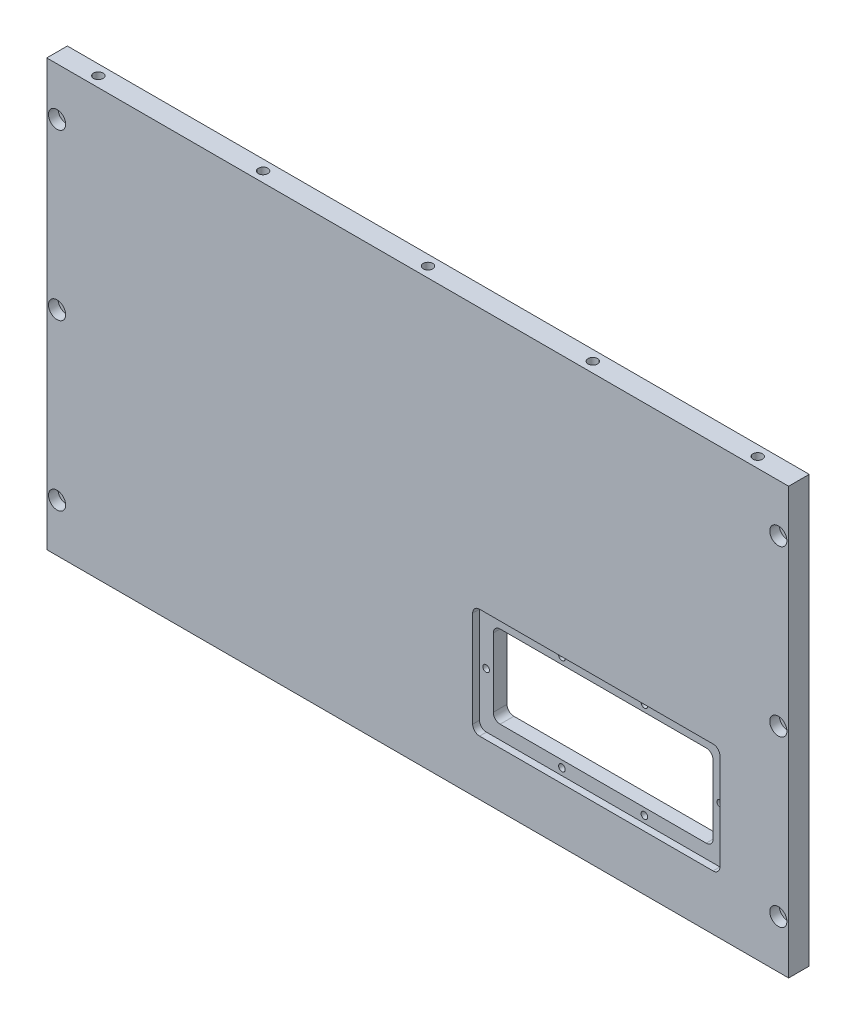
SolidWorks part; units mm, degrees
ref_plane "Front Plane" through (0, 0, 0) normal (0, 0, 1) x (1, 0, 0)
ref_plane "Top Plane" through (0, 0, 0) normal (0, 1, 0) x (1, 0, 0)
ref_plane "Right Plane" through (0, 0, 0) normal (1, 0, 0) x (0, 0, -1)
sketch "Sketch1" plane through (0, 0, 0) normal (0, 0, 1) x (1, 0, 0)
  line L1 (-171.45, 98.425) -> (171.45, 98.425)
  line L2 (-171.45, 98.425) -> (-171.45, -98.425)
  line L3 (-171.45, -98.425) -> (171.45, -98.425)
  line L4 (171.45, 98.425) -> (171.45, -98.425)
  line L5 (-171.45, 98.425) -> (171.45, -98.425) construction
  line L6 (-171.45, -98.425) -> (171.45, 98.425) construction
  point P0 (0, 0)
  dimension "D1" = 196.85
  dimension "D2" = 342.9
extrude "Boss-Extrude1" add sketch "Sketch1" along normal blind 9.525
sketch "Sketch2" plane through (0, 0, 9.525) normal (0, 0, 1) x (1, 0, 0)
  line L1 (34.925, -28.575) -> (130.175, -28.575)
  line L2 (31.75, -31.75) -> (31.75, -63.5)
  line L3 (34.925, -66.675) -> (130.175, -66.675)
  line L4 (133.35, -31.75) -> (133.35, -63.5)
  line L5 (31.75, -28.575) -> (133.35, -66.675) construction
  line L6 (31.75, -66.675) -> (133.35, -28.575) construction
  line L7 (-171.45, -98.425) -> (171.45, -98.425) construction
  line L8 (171.45, -98.425) -> (171.45, 98.425) construction
  arc A0 (133.35, -31.75) -> (130.175, -28.575) centre (130.175, -31.75) ccw
  arc A1 (133.35, -63.5) -> (130.175, -66.675) centre (130.175, -63.5) cw
  arc A2 (31.75, -63.5) -> (34.925, -66.675) centre (34.925, -63.5) ccw
  arc A3 (34.925, -28.575) -> (31.75, -31.75) centre (34.925, -31.75) ccw
  point P0 (82.55, -47.625)
  dimension "D4" = 3.175
  dimension "D1" = 50.8
  dimension "D2" = 38.1
  dimension "D3" = 101.6
  dimension "D5" = 88.9
extrude "Cut-Extrude1" cut sketch "Sketch2" against normal through all
sketch "Sketch3" plane through (0, 0, 9.525) normal (0, 0, 1) x (1, 0, 0)
  line L0 (31.75, -47.625) -> (133.35, -47.625) construction
  line L1 (31.75, -31.75) -> (31.75, -63.5) construction
  line L2 (133.35, -63.5) -> (133.35, -31.75) construction
  line L3 (82.55, -28.575) -> (82.55, -66.675) construction
  line L4 (130.175, -28.575) -> (34.925, -28.575) construction
  line L5 (34.925, -66.675) -> (130.175, -66.675) construction
  line L7 (28.575, -22.225) -> (136.525, -22.225)
  line L8 (25.4, -25.4) -> (25.4, -69.85)
  line L9 (28.575, -73.025) -> (136.525, -73.025)
  line L10 (139.7, -25.4) -> (139.7, -69.85)
  line L11 (25.4, -22.225) -> (139.7, -73.025) construction
  line L12 (25.4, -73.025) -> (139.7, -22.225) construction
  arc A0 (139.7, -69.85) -> (136.525, -73.025) centre (136.525, -69.85) cw
  arc A1 (136.525, -22.225) -> (139.7, -25.4) centre (136.525, -25.4) cw
  arc A2 (28.575, -22.225) -> (25.4, -25.4) centre (28.575, -25.4) ccw
  arc A3 (28.575, -73.025) -> (25.4, -69.85) centre (28.575, -69.85) cw
  point P12 (82.55, -47.625)
  dimension "D3" = 3.175
  dimension "D1" = 6.35
  dimension "D2" = 6.35
extrude "Cut-Extrude2" cut sketch "Sketch3" against normal blind 3.175
sketch "Sketch4" plane through (0, 0, 6.35) normal (0, 0, 1) x (1, 0, 0)
  line L0 (133.35, -63.5) -> (133.35, -31.75) construction
  line L1 (25.4, -47.625) -> (139.7, -47.625) construction
  line L2 (25.4, -25.4) -> (25.4, -69.85) construction
  line L3 (139.7, -69.85) -> (139.7, -25.4) construction
  line L4 (130.175, -28.575) -> (34.925, -28.575) construction
  line L5 (82.55, -28.575) -> (82.55, -66.675) construction
  line L6 (34.925, -66.675) -> (130.175, -66.675) construction
  circle A1 centre (63.5, -25.4) radius 1.524
  circle A2 centre (63.5, -69.85) radius 1.524
  circle A6 centre (101.6, -69.85) radius 1.524
  circle A7 centre (101.6, -25.4) radius 1.524
  circle A8 centre (136.652, -47.625) radius 1.524
  circle A9 centre (28.448, -47.625) radius 1.524
  dimension "D1" = 19.05
  dimension "D2" = 3.048
  dimension "D3" = 3.175
  dimension "D4" = 3.048
  dimension "D5" = 3.302
extrude "Cut-Extrude3" cut sketch "Sketch4" against normal through all
sketch "Sketch6" plane through (0, -98.425, 0) normal (0, -1, 0) x (-1, 0, 0)
  line L0 (171.45, -4.7625) -> (-171.45, -4.7625) construction
  line L1 (171.45, -9.525) -> (171.45, 0) construction
  line L2 (-171.45, -9.525) -> (-171.45, 0) construction
  line L3 (0, -9.525) -> (0, 0) construction
  line L4 (171.45, -9.525) -> (-171.45, -9.525) construction
  circle A0 centre (0, -4.7625) radius 2.1971
  circle A1 centre (76.2, -4.7625) radius 2.1971
  circle A2 centre (152.4, -4.7625) radius 2.1971
  circle A4 centre (-76.2, -4.7625) radius 2.1971
  circle A5 centre (-152.4, -4.7625) radius 2.1971
  dimension "D1" = 4.3942
  dimension "D2" = 3
  dimension "D3" = 3
extrude "Cut-Extrude4" cut sketch "Sketch6" against normal blind 15.24
sketch "Sketch7" plane through (0, 98.425, 0) normal (0, 1, 0) x (1, 0, 0)
  line L0 (-171.45, -4.7625) -> (171.45, -4.7625) construction
  line L1 (-171.45, -9.525) -> (-171.45, 0) construction
  line L2 (171.45, -9.525) -> (171.45, 0) construction
  line L3 (0, 0) -> (0, -9.525) construction
  line L4 (171.45, -9.525) -> (-171.45, -9.525) construction
  circle A0 centre (0, -4.7625) radius 2.1971
  circle A1 centre (76.2, -4.7625) radius 2.1971
  circle A2 centre (152.4, -4.7625) radius 2.1971
  circle A4 centre (-76.2, -4.7625) radius 2.1971
  circle A5 centre (-152.4, -4.7625) radius 2.1971
  dimension "D1" = 4.3942
  dimension "D2" = 3
  dimension "D3" = 3
extrude "Cut-Extrude5" cut sketch "Sketch7" against normal blind 15.24
sketch "Sketch8" plane through (0, 0, 9.525) normal (0, 0, 1) x (1, 0, 0)
  line L0 (-166.6875, 114.1123) -> (-166.6875, -125.0812) construction
  line L1 (-166.6875, 0) -> (187.1795, 0) construction
  line L2 (-171.45, 98.425) -> (-171.45, -98.425) construction
  line L3 (0, 98.425) -> (0, -98.425) construction
  line L4 (171.45, 98.425) -> (-171.45, 98.425) construction
  line L5 (-171.45, -98.425) -> (171.45, -98.425) construction
  circle A0 centre (-166.6875, 0) radius 1.905 construction
  circle A1 centre (-166.6875, 38.1) radius 1.905 construction
  circle A2 centre (-166.6875, 76.2) radius 1.905 construction
  circle A3 centre (-166.6875, -38.1) radius 1.905 construction
  circle A4 centre (-166.6875, -76.2) radius 1.905 construction
  circle A5 centre (166.6875, -76.2) radius 1.905 construction
  circle A6 centre (166.6875, -38.1) radius 1.905 construction
  circle A7 centre (166.6875, 76.2) radius 1.905 construction
  circle A8 centre (166.6875, 38.1) radius 1.905 construction
  circle A9 centre (166.6875, 0) radius 1.905 construction
  dimension "D2" = 3.81
  dimension "D1" = 4.7625
  dimension "D3" = 3
  dimension "D4" = 3
hole_wizard "CBORE for #8 Binding Head Machine Screw1" positions "Sketch9" profile "Sketch10" counterbore size "#8" standard "ANSI Inch"
sketch "Sketch9" plane through (0, 0, 9.525) normal (0, 0, 1) x (1, 0, 0)
  point P0 (-166.6875, 76.2)
  point P6 (-166.6875, 0)
  point P12 (-166.6875, -76.2)
  point P15 (166.6875, 76.2)
  point P21 (166.6875, 0)
  point P24 (166.6875, -76.2)
sketch "Sketch10" plane through (-166.6875, 76.2, 9.525) normal (1, 0, 0) x (0, -1, 0)
  line L0 (0, 0) -> (0, 9.525)
  line L1 (0, 9.525) -> (2.1526, 9.525)
  line L3 (2.1526, 9.525) -> (2.1527, 4.4196)
  line L4 (2.1527, 4.4196) -> (3.9687, 4.4196)
  line L5 (3.9687, 4.4196) -> (3.9687, 0)
  line L7 (3.9687, 0) -> (0, 0)
  line L11 (0, -6.35) -> (0, 107.95) construction
  dimension "Thru Hole Dia." = 4.3053
  dimension "Thru Hole Depth" = 9.525
  dimension "C'Bore Dia." = 7.9375
  dimension "C'Bore Depth" = 4.4196
